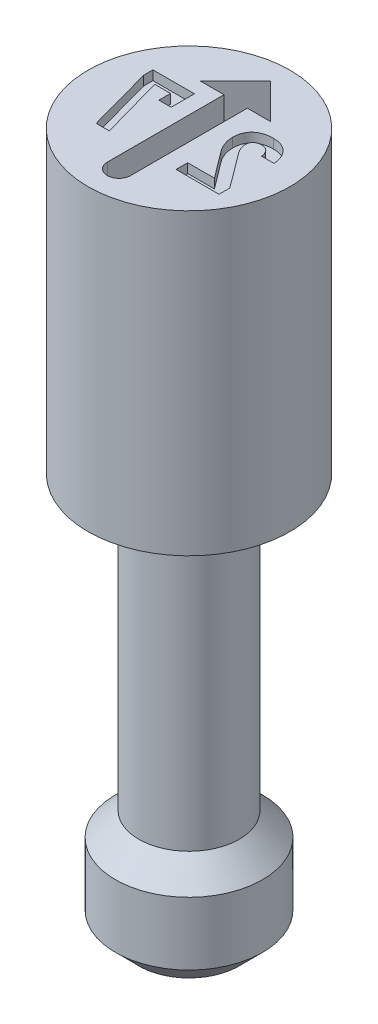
SolidWorks part; units mm, degrees
ref_plane "Front Plane" through (0, 0, 0) normal (0, 0, 1) x (1, 0, 0)
ref_plane "Top Plane" through (0, 0, 0) normal (0, 1, 0) x (1, 0, 0)
ref_plane "Right Plane" through (0, 0, 0) normal (1, 0, 0) x (0, 0, -1)
sketch "Sketch1" plane through (0, 0, 0) normal (0, 0, 1) x (1, 0, 0)
  line L0 (0, 7.62) -> (1.0986, 7.62)
  line L1 (0, -1.2084) -> (0, 1.2084) construction
  line L2 (1.0986, 7.62) -> (1.0986, 4.3688)
  line L3 (1.0986, 4.3688) -> (0.5461, 4.3688)
  line L4 (0.5461, 4.3688) -> (0.5461, 1.1938)
  line L5 (0.5461, 1.1938) -> (0.8, 0.9399)
  line L6 (0.8, 0.9399) -> (0.8, 0.254)
  line L7 (0.8, 0.254) -> (0.546, 0)
  line L8 (1.2084, 0) -> (-1.2084, 0) construction
  line L9 (0.546, 0) -> (0, 0)
  line L10 (0, 0) -> (0, 7.62)
  line L11 (0, 0) -> (0, 64.9194) construction
  dimension "D1" = 7.62
  dimension "D2" = 1.1938
  dimension "D3" = 0.254
  dimension "D4" = 45
  dimension "D5" = 1.6
  dimension "D6" = 2.1971
  dimension "D7" = 1.0922
  dimension "D8" = 3.2512
revolve "Revolve1" add sketch "Sketch1" angle 360 about L11
sketch "Sketch2" plane through (0, 7.62, 0) normal (0, 1, 0) x (1, 0, 0)
  line L1 (0.127, -0.762) -> (0.127, 0.508)
  line L2 (-0.127, -0.762) -> (-0.127, 0.508)
  line L3 (0, -1.2084) -> (0, 1.2084) construction
  line L4 (-0.127, 0.508) -> (-0.381, 0.508)
  line L5 (0.127, 0.508) -> (0.381, 0.508)
  line L6 (0.381, 0.508) -> (0, 0.889)
  line L7 (0, 0.889) -> (-0.381, 0.508)
  line L8 (-1.2084, 0) -> (1.2084, 0) construction
  arc A0 (-0.127, -0.762) -> (0.127, -0.762) centre (0, -0.762) ccw
  dimension "D6" = 0.762
  dimension "D1" = 0.254
  dimension "D3" = 0.762
  dimension "D4" = 0.381
  dimension "D5" = 45
  dimension "D7" = 0.508
extrude "Cut-Extrude1" cut sketch "Sketch2" against normal blind 0.4064
sketch "Sketch3" plane through (0, 7.62, 0) normal (0, 1, 0) x (1, 0, 0)
  text T0 "2 7" font "Bahnschrift SemiBold" height 0.8128
  dimension "D1" = 0.4572
extrude "Cut-Extrude2" cut sketch "Sketch3" against normal blind 0.1016
